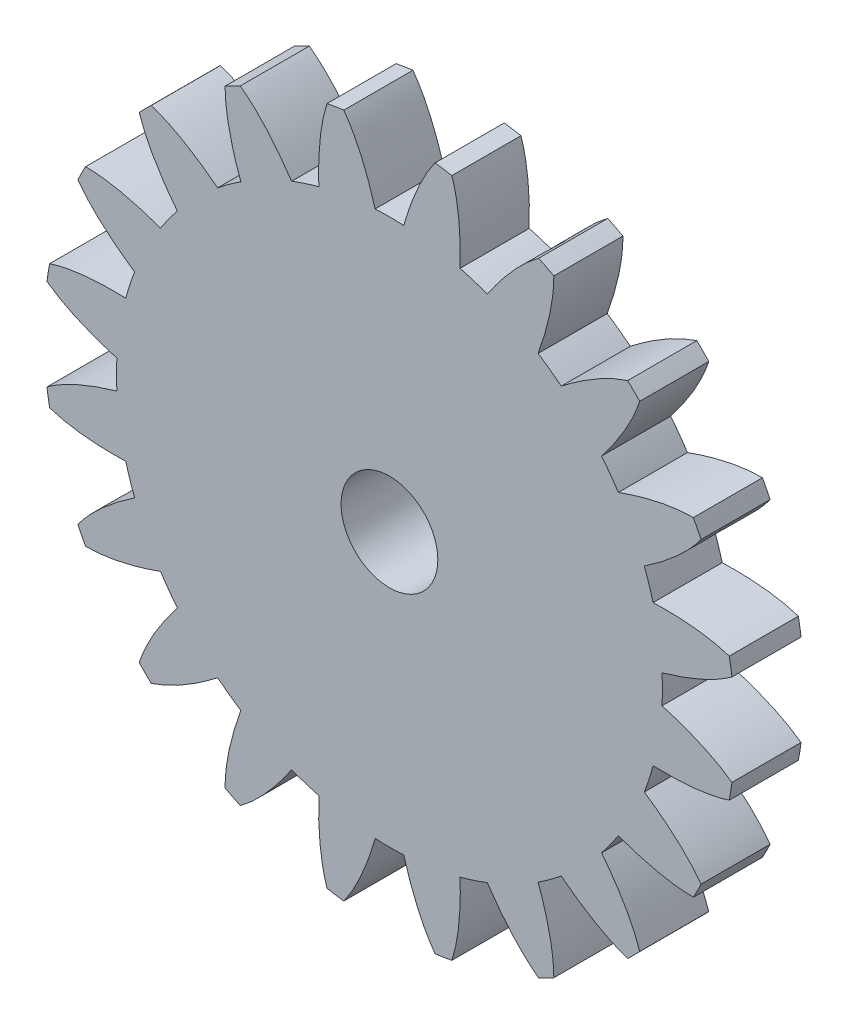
SolidWorks part; units mm, degrees
ref_plane "前基準面" through (0, 0, 0) normal (0, 0, 1) x (1, 0, 0)
ref_plane "上基準面" through (0, 0, 0) normal (0, 1, 0) x (1, 0, 0)
ref_plane "右基準面" through (0, 0, 0) normal (1, 0, 0) x (0, 0, -1)
sketch "草圖1" plane through (0, 0, 0) normal (0, 0, 1) x (1, 0, 0)
  line L0 (0, 0) -> (0, 50) construction
  line L1 (0, 0) -> (7.8217, 49.3844) construction
  line L2 (0, 0) -> (-7.8217, 49.3844) construction
  line L3 (0, 0) -> (-2.0673, 39.4459) construction
  line L4 (0, 0) -> (2.0673, 39.4459) construction
  line L5 (-6.6046, 49.5619) -> (-7.8217, 49.3844)
  line L6 (6.6046, 49.5619) -> (7.8217, 49.3844)
  circle A0 centre (0, 0) radius 7
  circle A1 centre (0, 0) radius 39.5
  circle A2 centre (0, 0) radius 45 construction
  circle A3 centre (0, 0) radius 50 construction
  spline S0 degree 2 poles (-2.0673, 39.4459) (-3.9394, 45.9074) (-6.6046, 49.5619) knots 0 0 0 1 1 1
  spline S1 degree 2 poles (2.0673, 39.4459) (3.9394, 45.9074) (6.6046, 49.5619) knots 0 0 0 1 1 1
  dimension "D1" = 100
  dimension "D2" = 90
  dimension "D3" = 79
  dimension "D4" = 14
  dimension "D5" = 18
  dimension "D6" = 6
  dimension "D7" = 1.23
sketch "草圖2" plane through (0, 0, 0) normal (0, 0, 1) x (1, 0, 0)
  line L0 (0, 63) -> (0, 45) construction
  line L1 (0, 63) -> (-6.8883, 46.3702) construction
  line L2 (0, 63) -> (6.8883, 46.3702) construction
  line L3 (0, 63) -> (-3.4455, 50.9842) construction
  line L4 (0, 63) -> (3.4455, 50.9842) construction
  line L5 (-1.625, 40) -> (1.625, 40)
  circle A0 centre (0, 63) radius 5
  circle A1 centre (0, 63) radius 12.5
  circle A2 centre (0, 63) radius 18 construction
  circle A3 centre (0, 0) radius 45 construction
  spline S0 degree 2 poles (-1.625, 40) (-3.9936, 45.6455) (-3.4455, 50.9842) knots 0 0 0 1 1 1
  spline S1 degree 2 poles (1.625, 40) (3.9936, 45.6455) (3.4455, 50.9842) knots 0 0 0 1 1 1
  point P14 (0, 40)
  dimension "D2" = 10
  dimension "D3" = 25
  dimension "D1" = 63
  dimension "D4" = 45
  dimension "D5" = 32
  dimension "D6" = 3.25
  dimension "D7" = 23
sketch "草圖3" plane through (0, 0, 0) normal (0, 0, 1) x (1, 0, 0)
  circle A0 centre (0, 0) radius 39.5 construction
  arc A1 (2.0673, 39.4459) -> (-2.0673, 39.4459) centre (0, 0) ccw
  arc A2 (14.1555, 36.8764) -> (10.2234, 38.1541) centre (0, 0) ccw
  arc A3 (24.8582, 30.6973) -> (21.5132, 33.1275) centre (0, 0) ccw
  arc A4 (33.1275, 21.5132) -> (30.6973, 24.8582) centre (0, 0) ccw
  arc A5 (38.1541, 10.2234) -> (36.8764, 14.1555) centre (0, 0) ccw
  arc A6 (39.4459, -2.0673) -> (39.4459, 2.0673) centre (0, 0) ccw
  arc A7 (36.8764, -14.1555) -> (38.1541, -10.2234) centre (0, 0) ccw
  arc A8 (30.6973, -24.8582) -> (33.1275, -21.5132) centre (0, 0) ccw
  arc A9 (21.5132, -33.1275) -> (24.8582, -30.6973) centre (0, 0) ccw
  arc A10 (10.2234, -38.1541) -> (14.1555, -36.8764) centre (0, 0) ccw
  arc A11 (-2.0673, -39.4459) -> (2.0673, -39.4459) centre (0, 0) ccw
  arc A12 (-14.1555, -36.8764) -> (-10.2234, -38.1541) centre (0, 0) ccw
  arc A13 (-24.8582, -30.6973) -> (-21.5132, -33.1275) centre (0, 0) ccw
  arc A14 (-33.1275, -21.5132) -> (-30.6973, -24.8582) centre (0, 0) ccw
  arc A15 (-38.1541, -10.2234) -> (-36.8764, -14.1555) centre (0, 0) ccw
  arc A16 (-39.4459, 2.0673) -> (-39.4459, -2.0673) centre (0, 0) ccw
  arc A17 (-36.8764, 14.1555) -> (-38.1541, 10.2234) centre (0, 0) ccw
  arc A18 (-30.6973, 24.8582) -> (-33.1275, 21.5132) centre (0, 0) ccw
  arc A19 (-21.5132, 33.1275) -> (-24.8582, 30.6973) centre (0, 0) ccw
  arc A20 (-10.2234, 38.1541) -> (-14.1555, 36.8764) centre (0, 0) ccw
  circle A21 centre (0, 0) radius 50 construction
  arc A22 (-6.6046, 49.5619) -> (-9.0341, 49.1771) centre (0, 0) ccw
  arc A23 (9.0341, 49.1771) -> (6.6046, 49.5619) centre (0, 0) ccw
  arc A24 (23.7885, 43.9785) -> (21.5968, 45.0952) centre (0, 0) ccw
  arc A25 (36.2143, 34.475) -> (34.475, 36.2143) centre (0, 0) ccw
  arc A26 (45.0952, 21.5968) -> (43.9785, 23.7885) centre (0, 0) ccw
  arc A27 (49.5619, 6.6046) -> (49.1771, 9.0341) centre (0, 0) ccw
  arc A28 (49.1771, -9.0341) -> (49.5619, -6.6046) centre (0, 0) ccw
  arc A29 (43.9785, -23.7885) -> (45.0952, -21.5968) centre (0, 0) ccw
  arc A30 (34.475, -36.2143) -> (36.2143, -34.475) centre (0, 0) ccw
  arc A31 (21.5968, -45.0952) -> (23.7885, -43.9785) centre (0, 0) ccw
  arc A32 (6.6046, -49.5619) -> (9.0341, -49.1771) centre (0, 0) ccw
  arc A33 (-9.0341, -49.1771) -> (-6.6046, -49.5619) centre (0, 0) ccw
  arc A34 (-23.7885, -43.9785) -> (-21.5968, -45.0952) centre (0, 0) ccw
  arc A35 (-36.2143, -34.475) -> (-34.475, -36.2143) centre (0, 0) ccw
  arc A36 (-45.0952, -21.5968) -> (-43.9785, -23.7885) centre (0, 0) ccw
  arc A37 (-49.5619, -6.6046) -> (-49.1771, -9.0341) centre (0, 0) ccw
  arc A38 (-49.1771, 9.0341) -> (-49.5619, 6.6046) centre (0, 0) ccw
  arc A39 (-43.9785, 23.7885) -> (-45.0952, 21.5968) centre (0, 0) ccw
  arc A40 (-34.475, 36.2143) -> (-36.2143, 34.475) centre (0, 0) ccw
  arc A41 (-21.5968, 45.0952) -> (-23.7885, 43.9785) centre (0, 0) ccw
  circle A42 centre (0, 0) radius 7 construction
  circle A43 centre (0, 0) radius 7
  parabola Q0 construction
  parabola Q1 construction
  parabola Q2
  parabola Q3
  parabola Q4
  parabola Q5
  parabola Q6
  parabola Q7
  parabola Q8
  parabola Q9
  parabola Q10
  parabola Q11
  parabola Q12
  parabola Q13
  parabola Q14
  parabola Q15
  parabola Q16
  parabola Q17
  parabola Q18
  parabola Q19
  parabola Q20
  parabola Q21
  parabola Q22
  parabola Q23
  parabola Q24
  parabola Q25
  parabola Q26
  parabola Q27
  parabola Q28
  parabola Q29
  parabola Q30
  parabola Q31
  parabola Q32
  parabola Q33
  parabola Q34
  parabola Q35
  parabola Q36
  parabola Q37
  parabola Q38
  parabola Q39
  parabola Q40
  parabola Q41
  point P169 (0, 0)
  dimension "D1" = 20
extrude "填料-伸長1" add sketch "草圖3" along normal mid plane 10
